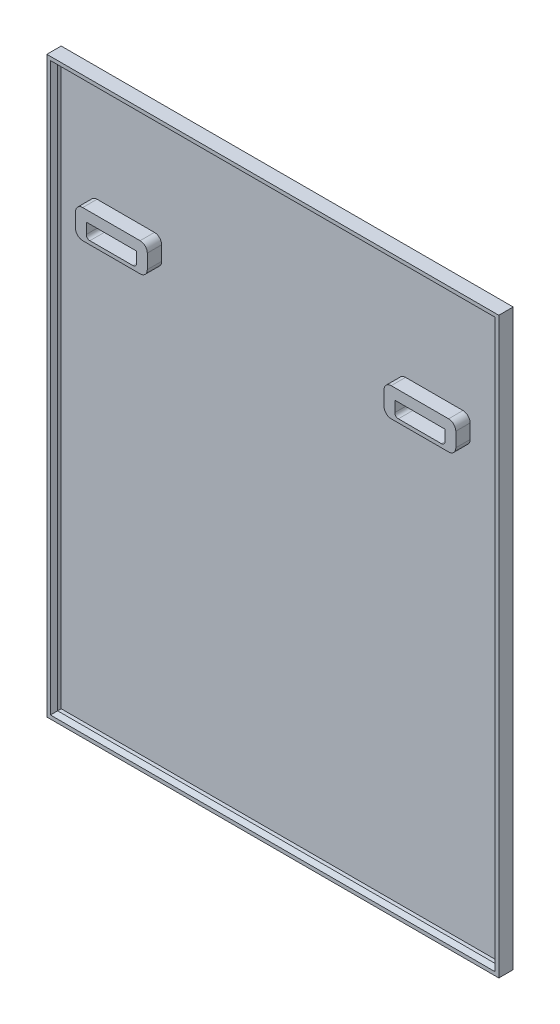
SolidWorks part; units mm, degrees
ref_plane "前基準面" through (0, 0, 0) normal (0, 0, 1) x (1, 0, 0)
ref_plane "上基準面" through (0, 0, 0) normal (0, 1, 0) x (1, 0, 0)
ref_plane "右基準面" through (0, 0, 0) normal (1, 0, 0) x (0, 0, -1)
sketch "草圖1" plane through (0, 0, 0) normal (0, 0, 1) x (1, 0, 0)
  line L0 (630, 0) -> (630, -800)
  line L1 (0, 0) -> (630, 0)
  line L2 (0, 0) -> (0, -800)
  line L3 (0, -800) -> (630, -800)
  dimension "D1" = 630
  dimension "D2" = 800
extrude "填料-伸長1" add sketch "草圖1" along normal blind 20
shell "薄殼2" thickness 10
shell "薄殼4" thickness 10
chamfer "導角1" distance 5 angle 45 4 edges at (315, -790, 20) (10, -400, 20) (315, -10, 20) (620, -400, 20)
sketch "草圖2" plane through (0, 0, 10) normal (0, 0, 1) x (1, 0, 0)
  line L0 (0, 0) -> (0, -800) construction
  line L1 (60, -150) -> (140, -150)
  line L2 (50, -160) -> (50, -180)
  line L3 (60, -190) -> (140, -190)
  line L4 (150, -160) -> (150, -180)
  line L5 (490, -150) -> (570, -150)
  line L6 (480, -160) -> (480, -180)
  line L7 (490, -190) -> (570, -190)
  line L8 (580, -160) -> (580, -180)
  line L9 (630, 0) -> (0, 0) construction
  line L10 (630, -800) -> (630, 0) construction
  line L11 (630, 0) -> (0, 0) construction
  arc A0 (150, -180) -> (140, -190) centre (140, -180) cw
  arc A1 (150, -160) -> (140, -150) centre (140, -160) ccw
  arc A2 (50, -180) -> (60, -190) centre (60, -180) ccw
  arc A3 (60, -150) -> (50, -160) centre (60, -160) ccw
  arc A4 (580, -180) -> (570, -190) centre (570, -180) cw
  arc A5 (580, -160) -> (570, -150) centre (570, -160) ccw
  arc A6 (480, -180) -> (490, -190) centre (490, -180) ccw
  arc A7 (480, -160) -> (490, -150) centre (490, -160) cw
  point P16 (150, -150)
  point P19 (50, -190)
  point P22 (50, -150)
  point P27 (580, -150)
  point P30 (480, -190)
  point P33 (480, -150)
  dimension "D8" = 10
  dimension "D9" = 10
  dimension "D1" = 100
  dimension "D2" = 100
  dimension "D3" = 40
  dimension "D4" = 40
  dimension "D5" = 50
  dimension "D6" = 50
  dimension "D7" = 150
  dimension "D10" = 150
extrude "填料-伸長2" add sketch "草圖2" along normal blind 20
sketch "草圖3" plane through (0, 0, 30) normal (0, 0, 1) x (1, 0, 0)
  line L0 (50, -160) -> (50, -180) construction
  line L1 (65, -165) -> (135, -165)
  line L2 (65, -165) -> (65, -180)
  line L3 (70, -185) -> (130, -185)
  line L4 (135, -165) -> (135, -180)
  line L5 (495, -165) -> (565, -165)
  line L6 (495, -165) -> (495, -180)
  line L7 (500, -185) -> (560, -185)
  line L8 (565, -165) -> (565, -180)
  line L9 (480, -160) -> (480, -180) construction
  line L10 (140, -150) -> (60, -150) construction
  line L11 (570, -150) -> (490, -150) construction
  arc A0 (565, -180) -> (560, -185) centre (560, -180) cw
  arc A1 (495, -180) -> (500, -185) centre (500, -180) ccw
  arc A2 (135, -180) -> (130, -185) centre (130, -180) cw
  arc A3 (65, -180) -> (70, -185) centre (70, -180) ccw
  point P21 (495, -185)
  point P26 (65, -185)
  dimension "D9" = 5
  dimension "D1" = 70
  dimension "D2" = 70
  dimension "D3" = 20
  dimension "D4" = 20
  dimension "D5" = 15
  dimension "D6" = 15
  dimension "D7" = 15
  dimension "D8" = 15
extrude "除料-伸長1" cut sketch "草圖3" against normal blind 20
